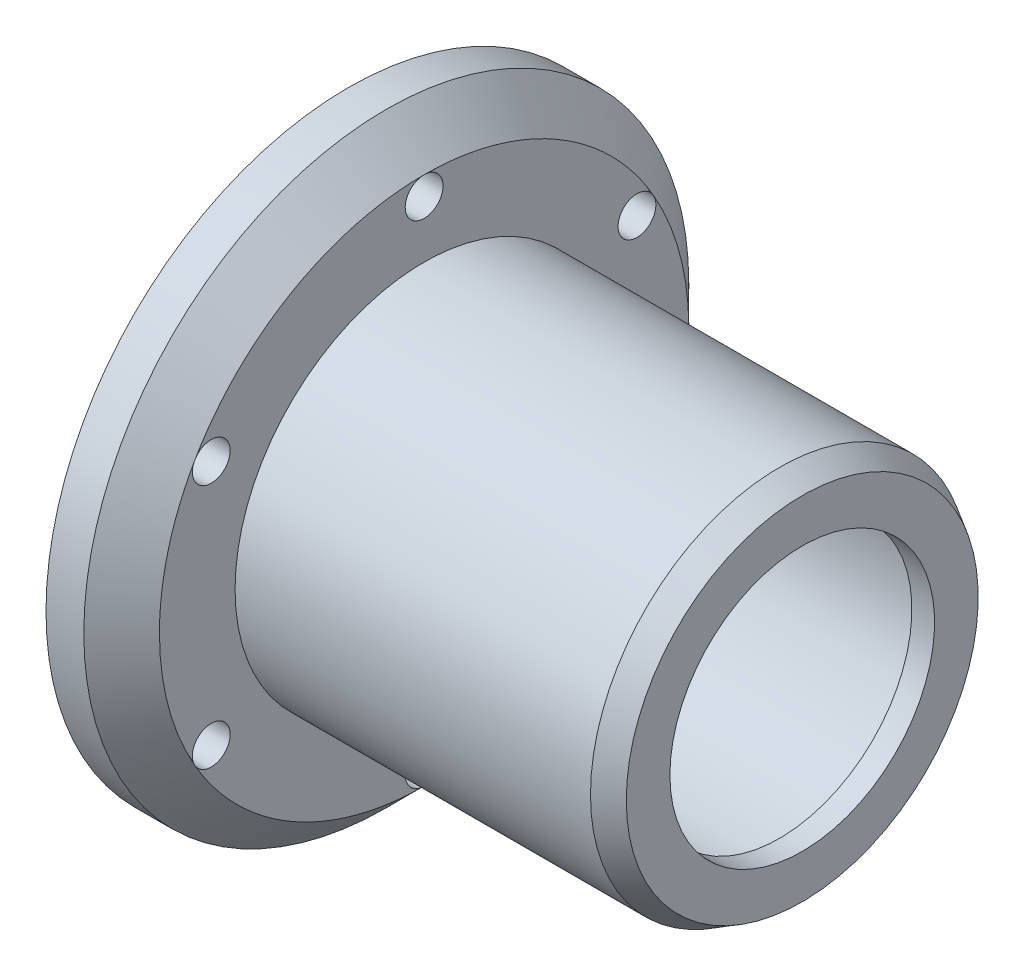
SolidWorks part; units mm, degrees
ref_plane "Face" through (0, 0, 0) normal (0, 0, 1) x (1, 0, 0)
ref_plane "Dessus" through (0, 0, 0) normal (0, 1, 0) x (1, 0, 0)
ref_plane "Droite" through (0, 0, 0) normal (1, 0, 0) x (0, 0, -1)
sketch "Esquisse1" plane through (0, 0, 0) normal (0, 0, 1) x (1, 0, 0)
  line L0 (0, 0) -> (108.1959, 0) construction
  line L1 (1.4879, 21) -> (57.4879, 21)
  line L2 (57.4879, 21) -> (57.4879, 17.5)
  line L3 (57.4879, 17.5) -> (60.4879, 17.5)
  line L4 (60.4879, 17.5) -> (60.4879, 23.2679)
  line L5 (57.4879, 25) -> (10.4879, 25)
  line L6 (10.4879, 25) -> (10.4879, 35)
  line L7 (5.4879, 40) -> (0.4879, 40)
  line L8 (0.4879, 40) -> (0.4879, 26.6)
  line L9 (10.4879, 35) -> (5.4879, 40)
  line L10 (0.4879, 21.5774) -> (1.4879, 21)
  line L11 (0.4879, 23) -> (0.4879, 21.5774)
  line L12 (0.4879, 26.6) -> (2.0879, 26.6)
  line L13 (60.4879, 23.2679) -> (57.4879, 25)
  line L14 (0.4879, 23) -> (2.0879, 23)
  line L15 (2.0879, 26.6) -> (2.0879, 23)
  point P3 (0.4879, 21)
  point P8 (60.4879, 25)
  point P10 (10.4879, 40)
  dimension "D1" = 35
  dimension "D2" = 42
  dimension "D3" = 50
  dimension "D4" = 80
  dimension "D5" = 10
  dimension "D6" = 3
  dimension "D7" = 60
  dimension "D8" = 5
  dimension "D9" = 45
  dimension "D10" = 1
  dimension "D11" = 30
  dimension "D12" = 3.6
  dimension "D13" = 46
  dimension "D14" = 1.6
  dimension "D15" = 3
  dimension "D16" = 30
revolve "Révolution1" add sketch "Esquisse1" angle 360 about L0
sketch "Esquisse2" plane through (0.4879, 0, 0) normal (-1, 0, 0) x (0, 0, 1)
  line L0 (0, 0) -> (0, 43.2355) construction
hole_wizard "Trou taraudé M61" positions "Esquisse4" profile "Esquisse3" tap size "M6" standard "ISO"
sketch "Esquisse4" plane through (0.4879, 0, 0) normal (-1, 0, 0) x (0, 0, 1)
  line L0 (0, 0) -> (0, 43.2355) construction
  circle A0 centre (0, 0) radius 17.5 construction
  point P0 (0, 32.5)
  dimension "D1" = 32.5
sketch "Esquisse3" plane through (0.4879, 32.5, 0) normal (0, 1, 0) x (0, 0, 1)
  line L0 (0, 0) -> (0, 60)
  line L1 (0, 60) -> (2.5, 60)
  line L2 (2.5, 60) -> (2.5, 0)
  line L5 (2.5, 0) -> (0, 0)
  line L11 (0, -6.35) -> (0, 107.95) construction
  dimension "Diamètre du trou pour taraudage jusqu'au prochain" = 5
  dimension "Profondeur du trou pour taraudage jusqu'au prochain" = 60
pattern_circular "Répétition circulaire1" count 6 every 60 about axis through (0, 0, 0) along (1, 0, 0) of "Trou taraudé M61"
